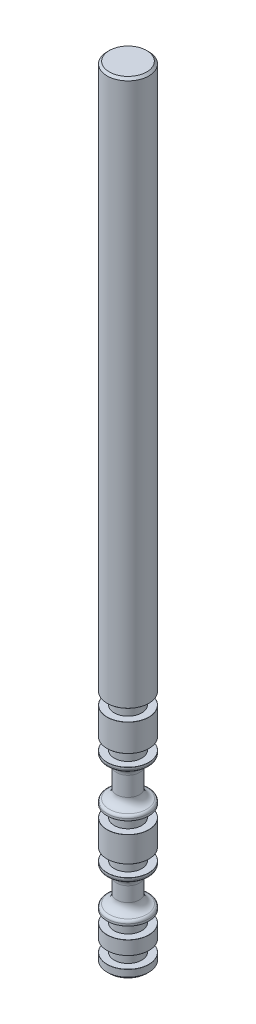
SolidWorks part; units mm, degrees
ref_plane "Front Plane" through (0, 0, 0) normal (0, 0, 1) x (1, 0, 0)
ref_plane "Top Plane" through (0, 0, 0) normal (0, 1, 0) x (1, 0, 0)
ref_plane "Right Plane" through (0, 0, 0) normal (1, 0, 0) x (0, 0, -1)
sketch "Sketch1" plane through (0, 0, 0) normal (0, 0, 1) x (1, 0, 0)
  line L0 (0, -5.9466) -> (0, 67.1677) construction
  line L1 (0, -2.5245) -> (0, 2.5245) construction
  line L2 (0, 85.69) -> (2.295, 85.69)
  line L3 (2.295, 85.69) -> (2.295, 0)
  line L20 (2.5245, 0) -> (-2.5245, 0) construction
  line L21 (2.295, 0) -> (0, 0)
  line L22 (0, 0) -> (0, 85.69)
  dimension "D1" = 85.69
  dimension "D2" = 4.59
revolve "Revolve1" add sketch "Sketch1" angle 360 about L0
sketch "Sketch2" plane through (0, 0, 0) normal (0, 0, 1) x (1, 0, 0)
  line L0 (1.51, 21.5) -> (2.5385, 21.5)
  line L1 (2.5385, 5.1) -> (2.5385, 5.6)
  line L2 (3.8195, 25.8) -> (3.8195, 1)
  line L3 (2.5245, 0) -> (-2.5245, 0) construction
  line L4 (1.51, 11) -> (2.5385, 11)
  line L5 (1.51, 11) -> (1.51, 9.7)
  line L6 (1.51, 9.7) -> (2.5385, 9.7)
  line L7 (2.5385, 5.6) -> (1.25, 5.6)
  line L8 (2.5385, 5.1) -> (1.51, 5.1)
  line L9 (1.51, 5.1) -> (1.51, 3.8)
  line L10 (1.51, 3.8) -> (2.5385, 3.8)
  line L11 (1.51, 21.5) -> (1.51, 20.2)
  line L12 (1.51, 20.2) -> (2.5385, 20.2)
  line L13 (2.5385, 19.7) -> (2.5385, 20.2)
  line L14 (1.25, 15.6) -> (1.25, 19.7)
  line L15 (2.5385, 3.8) -> (2.5385, 2.3)
  line L16 (2.5385, 2.3) -> (1.51, 2.3)
  line L17 (1.51, 2.3) -> (1.51, 1)
  line L18 (1.51, 1) -> (3.8195, 1)
  line L19 (1.25, 5.6) -> (1.25, 9.2)
  line L20 (1.25, 9.2) -> (2.5385, 9.2)
  line L21 (2.5385, 9.2) -> (2.5385, 9.7)
  line L22 (1.25, 19.7) -> (2.5385, 19.7)
  line L24 (2.5385, 15.6) -> (1.25, 15.6)
  line L25 (2.5385, 15.1) -> (2.5385, 15.6)
  line L26 (2.5385, 15.1) -> (1.51, 15.1)
  line L27 (1.51, 15.1) -> (1.51, 13.8)
  line L28 (1.51, 13.8) -> (2.5385, 13.8)
  line L29 (2.5385, 13.8) -> (2.5385, 11)
  line L30 (0, 86.3657) -> (0, -6.9495) construction
  line L31 (2.5385, 21.5) -> (2.5385, 24.5)
  line L32 (2.5385, 24.5) -> (1.51, 24.5)
  line L33 (1.51, 24.5) -> (1.51, 25.8)
  line L34 (1.51, 25.8) -> (3.8195, 25.8)
  dimension "D1" = 1
  dimension "D3" = 1.3
  dimension "D5" = 5.6
  dimension "D6" = 0.5
  dimension "D7" = 1.3
  dimension "D8" = 9.2
  dimension "D9" = 2.3095
  dimension "D10" = 3.02
  dimension "D11" = 2.5
  dimension "D12" = 5.0769
  dimension "D13" = 3
  dimension "D14" = 0.5
  dimension "D15" = 1.3
  dimension "D16" = 0.5
  dimension "D17" = 1.3
  dimension "D18" = 5.0769
  dimension "D19" = 5.0769
  dimension "D20" = 2.5
  dimension "D21" = 5.0769
  dimension "D22" = 15.6
  dimension "D23" = 19.7
revolve "Cut-Revolve3" cut sketch "Sketch2" angle 360 about L30
pattern_linear "LPattern1" [suppressed] count 2 spacing 10
fillet "Fillet1" radius 1 4 edges at (0, 5.6, 1.25) (0, 9.2, 1.25) (0, 15.6, 1.25) (0, 19.7, 1.25)
fillet "Fillet2" radius 0.3 4 edges at (0, 19.7, -2.295) (0, 15.6, 2.295) (0, 9.2, -2.295) (0, 5.6, 2.295)
hole_wizard "M2.5x0.45 Tapped Hole1" positions "Sketch4" profile "Sketch3" tap size "M2.5x0.45" standard "ANSI Metric"
sketch "Sketch4" plane through (0, 85.69, 0) normal (0, 1, 0) x (1, 0, 0)
  point P0 (0, 0)
sketch "Sketch3" plane through (0, 85.69, 0) normal (1, 0, 0) x (0, 0, 1)
  line L0 (0, 0) -> (0, 6.9659)
  line L1 (0, 6.9659) -> (1.025, 6.35)
  line L2 (1.025, 6.35) -> (1.025, 0)
  line L5 (1.025, 0) -> (0, 0)
  line L10 (0, 6.9659) -> (-1.025, 6.35) construction
  line L11 (0, -6.35) -> (0, 107.95) construction
  dimension "Tap Drill Dia." = 2.05
  dimension "Tap Drill Depth" = 6.35
  dimension "Drill Angle" = 118
chamfer "Chamfer1" distance 0.01 angle 45 12 edges at (0, 25.8, -2.295) (0, 24.5, 2.295) (0, 21.5, -2.295) (0, 20.2, 2.295) (0, 15.1, -2.295) (0, 13.8, 2.295) (0, 11, -2.295) (0, 9.7, 2.295) (0, 5.1, -2.295) (0, 3.8, 2.295) (0, 2.3, -2.295) (0, 1, 2.295)
chamfer "Chamfer2" distance 0.25 angle 45 2 edges at (0, 0, -2.295) (0, 85.69, -2.295)
